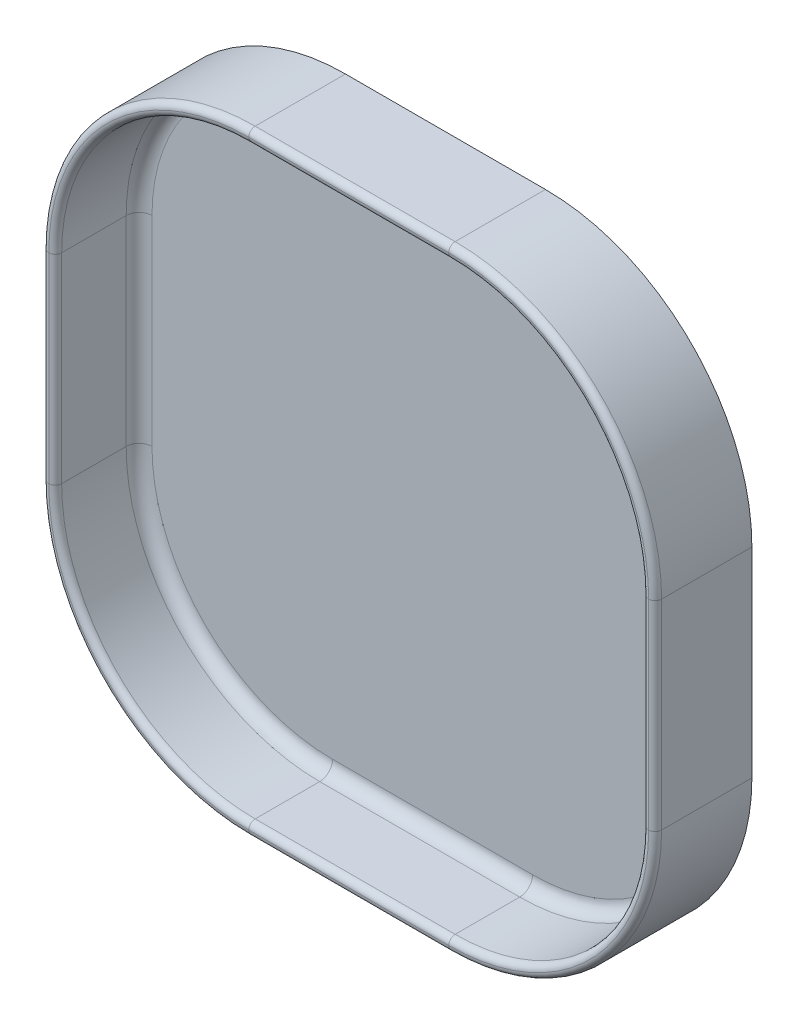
SolidWorks part; units mm, degrees
ref_plane "Front Plane" through (0, 0, 0) normal (0, 0, 1) x (1, 0, 0)
ref_plane "Top Plane" through (0, 0, 0) normal (0, 1, 0) x (1, 0, 0)
ref_plane "Right Plane" through (0, 0, 0) normal (1, 0, 0) x (0, 0, -1)
sketch "Sketch1" plane through (0, 0, 0) normal (0, 1, 0) x (1, 0, 0)
  line L1 (-47.5, 47.5) -> (47.5, 47.5)
  line L2 (-47.5, 47.5) -> (-47.5, -47.5)
  line L3 (-47.5, -47.5) -> (47.5, -47.5)
  line L4 (47.5, 47.5) -> (47.5, -47.5)
  line L5 (-47.5, 47.5) -> (47.5, -47.5) construction
  line L6 (-47.5, -47.5) -> (47.5, 47.5) construction
  point P0 (0, 0)
  dimension "D1" = 95
  dimension "D2" = 95
extrude "Boss-Extrude1" add sketch "Sketch1" along normal blind 15
sketch "Sketch3" plane through (0, 15, 0) normal (0, 1, 0) x (1, 0, 0)
  line L0 (-47.5, 47.5) -> (-47.5, -47.5) construction
  line L1 (-45.5, 45.5) -> (45.5, 45.5)
  line L2 (-45.5, 45.5) -> (-45.5, -45.5)
  line L3 (-45.5, -45.5) -> (45.5, -45.5)
  line L4 (45.5, 45.5) -> (45.5, -45.5)
  line L5 (-45.5, 45.5) -> (45.5, -45.5) construction
  line L6 (-45.5, -45.5) -> (45.5, 45.5) construction
  line L7 (-47.5, -47.5) -> (47.5, -47.5) construction
  point P0 (0, 0)
  dimension "D1" = 2
  dimension "D2" = 2
extrude "Cut-Extrude1" cut sketch "Sketch3" against normal blind 13
fillet "Fillet1" radius 30 4 edges at (-45.5, 8.5, 45.5) (45.5, 8.5, 45.5) (45.5, 8.5, -45.5) (-45.5, 8.5, -45.5)
fillet "Fillet3" radius 2 8 edges at (36.7132, 2, -36.7132) (45.5, 2, 0) (36.7132, 2, 36.7132) (0, 2, 45.5) (-36.7132, 2, 36.7132) (-45.5, 2, 0) (-36.7132, 2, -36.7132) (0, 2, -45.5)
move or copy body "Body-Move/Copy1" bodies to move or copy 102 copy no rotation origin (0, 0, 0) rotation axis (0, 1, 0) rotation angle 45
fillet "Fillet4" radius 32 4 edges at (0, 7.5, -67.1751) (0, 7.5, 67.1751) (67.1751, 7.5, 0) (-67.1751, 7.5, 0)
fillet "Fillet5" radius 1 16 edges at (33.5876, 15, -33.5876) (53.9203, 15, 0) (33.5876, 15, 33.5876) (0, 15, 53.9203) (-33.5876, 15, 33.5876) (-53.9203, 15, 0) (-33.5876, 15, -33.5876) (-32.1734, 15, -32.1734) (-51.9203, 15, 0) (-32.1734, 15, 32.1734) (0, 15, 51.9203) (32.1734, 15, 32.1734) (51.9203, 15, 0) (32.1734, 15, -32.1734) (0, 15, -53.9203) (0, 15, -51.9203)
move or copy body "Body-Move/Copy2" bodies to move or copy 103 copy no rotation origin (-2.3129, 6.542, -0.958) rotation axis (0.8629, 0.3574, 0.3574) rotation angle 98.421
